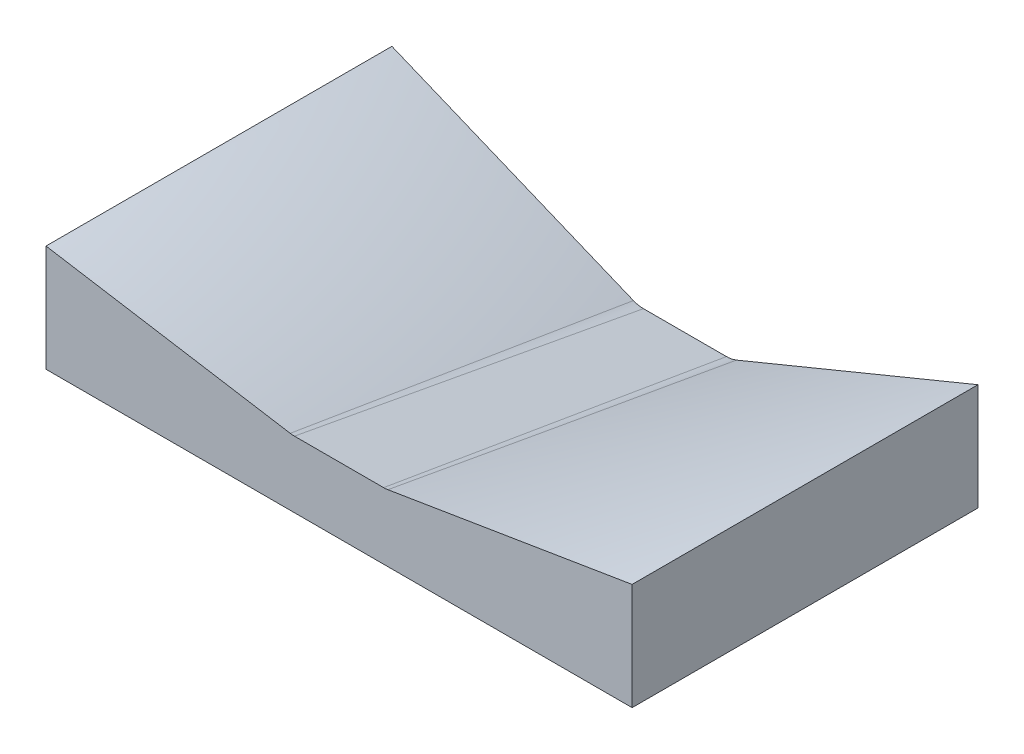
SolidWorks part; units mm, degrees
ref_plane "前视基准面" through (0, 0, 0) normal (0, 0, 1) x (1, 0, 0)
ref_plane "上视基准面" through (0, 0, 0) normal (0, 1, 0) x (1, 0, 0)
ref_plane "右视基准面" through (0, 0, 0) normal (1, 0, 0) x (0, 0, -1)
sketch "草图1" plane through (0, 0, 0) normal (1, 0, 0) x (0, 0, -1)
  line L0 (0, 0) -> (129.6, 0)
  line L1 (129.6, 0) -> (129.6, 2)
  line L2 (129.6, 2) -> (0, 24.852)
  line L3 (0, 24.852) -> (0, 0)
  dimension "D1" = 2
  dimension "D2" = 10
  dimension "D3" = 129.6
extrude "凸台-拉伸1" add sketch "草图1" along normal mid plane 35
ref_plane "基准面1" through (-109.8, 0, 0) normal (1, 0, 0) x (0, 0, -1)
sketch "草图2" plane through (-109.8, 0, 0) normal (1, 0, 0) x (0, 0, -1)
  line L0 (129.6, 0) -> (129.6, 2) construction
  line L1 (0, 0) -> (129.6, 0)
  line L2 (0, 0) -> (0, 40)
  line L3 (0, 40) -> (129.6, 40)
  line L4 (129.6, 0) -> (129.6, 40)
  dimension "D1" = 40
sketch "草图4" plane through (-17.5, 0, 0) normal (-1, 0, 0) x (0, 0, 1)
  line L4 (0, 0) -> (0, 24.852)
  line L5 (0, 24.852) -> (-129.6, 2)
  line L6 (-129.6, 2) -> (-129.6, 0)
  line L7 (-129.6, 0) -> (0, 0)
  line L8 (0, 0) -> (0, 24.852)
  line L9 (0, 24.852) -> (-129.6, 2)
  line L10 (-129.6, 2) -> (-129.6, 0)
  line L11 (-129.6, 0) -> (0, 0)
  dimension "D1" = 0
other "边界2"
mirror "镜向9" about plane through (0, 0, 0) normal (1, 0, 0) of "边界2"
fillet "圆角1" radius 10 2 edges at (17.5, 13.426, -64.8) (-17.5, 13.426, -64.8)
